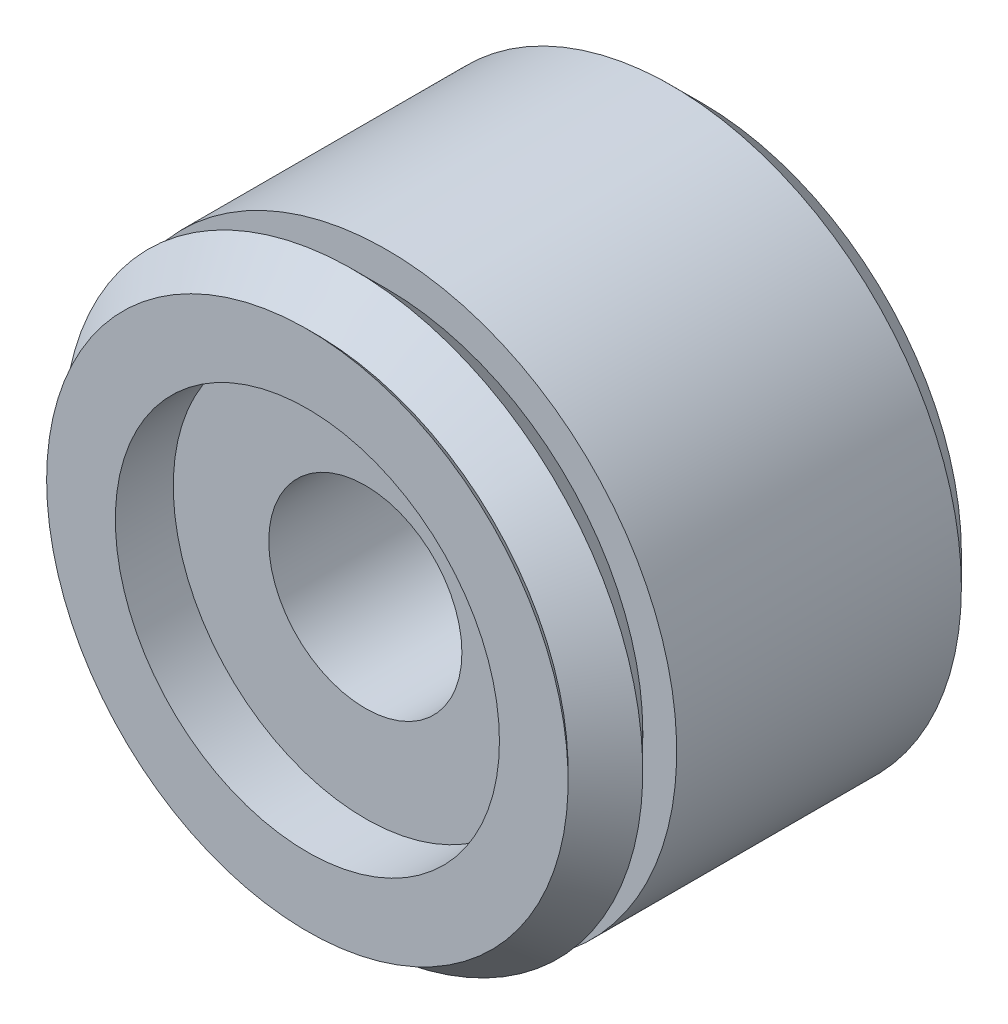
SolidWorks part; units mm, degrees
ref_plane "Front" through (0, 0, 0) normal (0, 0, 1) x (1, 0, 0)
ref_plane "Top" through (0, 0, 0) normal (0, 1, 0) x (1, 0, 0)
ref_plane "Right" through (0, 0, 0) normal (1, 0, 0) x (0, 0, -1)
sketch "Sketch1" plane through (0, 0, 0) normal (1, 0, 0) x (0, 0, -1)
  line L0 (71.2941, 0) -> (-67.6458, 0) construction
  line L1 (0, 0) -> (0, 6.858)
  line L2 (0, 6.858) -> (0.2197, 6.6383)
  line L3 (0.2197, 6.6383) -> (1.2014, 7.62)
  line L4 (1.2014, 7.62) -> (2.0932, 6.7282)
  line L5 (2.0932, 6.7282) -> (2.0932, 7.62)
  line L6 (2.0932, 7.62) -> (10.3736, 7.62)
  line L7 (10.3736, 7.62) -> (10.3736, 0)
  line L8 (10.3736, 0) -> (0, 0)
  dimension "D1" = 45
  dimension "D2" = 7.62
  dimension "D3" = 7.62
  dimension "D4" = 0.8918
  dimension "D5" = 1.2014
  dimension "D6" = 6.858
  dimension "Back Length" = 8.2804
revolve "Base" add sketch "Sketch1" angle 360 about L0
chamfer "Back Chamfer" distance 0.7937 angle 45 1 edges at (-7.62, 0, -10.3736)
sketch "Sketch2" plane through (0, 0, -10.3736) normal (0, 0, -1) x (-1, 0, 0)
  line L0 (6.6282, 0) -> (-6.4494, 0) construction
  line L1 (7.62, 4.7625) -> (-7.62, 4.7625)
  line L2 (7.62, -4.7625) -> (-7.62, -4.7625)
  line L3 (-7.62, 4.7625) -> (-7.62, 17.4625)
  line L4 (-7.62, -4.7625) -> (-7.62, -17.4625)
  line L5 (-7.62, 17.4625) -> (7.62, 17.4625)
  line L6 (-7.62, -17.4625) -> (7.62, -17.4625)
  line L7 (7.62, 17.4625) -> (7.62, 4.7625)
  line L8 (7.62, -17.4625) -> (7.62, -4.7625)
  point P5 (0, 4.7625)
  dimension "D1" = 9.525
  dimension "D2" = 12.7
  dimension "D3" = 15.24
extrude "Flats Cut" [suppressed] cut sketch "Sketch2" against normal blind 3.9688
sketch "Sketch4" plane through (0, 0, -10.3736) normal (0, 0, -1) x (-1, 0, 0)
  circle A0 centre (0, 0) radius 9.525
  dimension "D1" = 19.05
extrude "Body" [suppressed] add sketch "Sketch4" along normal blind 9.525
sketch "Sketch5" [suppressed] plane through (0, 0, -16.6982) normal (0, 0, -1) x (-1, 0, 0)
  circle A0 centre (0, 0) radius 6.35
  dimension "D1" = 12.7
extrude "Body 2" [suppressed] add sketch "Sketch5" along normal blind 12.7
chamfer "Body Chamfer" [suppressed] distance 0.7937 angle 45
sketch "Sketch6" [suppressed] plane through (0, 0, -26.2232) normal (0, 0, -1) x (-1, 0, 0)
  line L0 (0, 6.5811) -> (0, -6.7371) construction
  line L1 (-3.9687, 6.35) -> (-3.9687, -6.35)
  line L2 (3.9688, 6.35) -> (6.5088, 6.35)
  line L3 (3.9688, 6.35) -> (3.9688, -6.35)
  line L4 (3.9688, -6.35) -> (6.5088, -6.35)
  line L5 (6.5088, 6.35) -> (6.5088, -6.35)
  line L6 (-3.9687, 6.35) -> (-6.5087, 6.35)
  line L7 (-6.5087, 6.35) -> (-6.5087, -6.35)
  line L8 (-3.9687, -6.35) -> (-6.5087, -6.35)
  point P11 (3.9688, 0)
  dimension "D1" = 7.9375
  dimension "D2" = 2.54
  dimension "D3" = 12.7
extrude "Body 2 Flats Cut" [suppressed] cut sketch "Sketch6" against normal blind 11.8872
sketch "Sketch7" [suppressed] plane through (3.9687, 0, 0) normal (1, 0, 0) x (0, 0, -1)
  line L0 (12.7295, 0) -> (3.9982, 0) construction
  line L1 (26.2232, -3.8886) -> (26.2232, 3.8886) construction
  circle A0 centre (19.8732, 0) radius 1.9812
  dimension "D2" = 3.9624
  dimension "D1" = 6.35
extrude "Body 2 Hole Cut" [suppressed] cut sketch "Sketch7" against normal through all
sketch "Sketch8" [suppressed] plane through (0, 0, 0) normal (1, 0, 0) x (0, 0, -1)
  line L0 (15.9045, 0) -> (3.9982, 0) construction
  line L1 (3.9982, 9.525) -> (3.9982, -9.525) construction
  circle A0 centre (8.5194, 0) radius 2.032
  dimension "D1" = 4.064
  dimension "B4 Body Hole Distance" = 4.7752
extrude "B1" [suppressed] cut sketch "Sketch8" along normal through all
sketch "Sketch12" [suppressed] plane through (0, 0, 0) normal (0, 1, 0) x (1, 0, 0)
  line L0 (-9.525, 3.9982) -> (9.525, 3.9982) construction
  circle A0 centre (0, 8.5194) radius 2.032
  dimension "D1" = 4.064
  dimension "B1 Body Hole Distance" = 4.7752
extrude "B2" [suppressed] cut sketch "Sketch12" along normal through all
sketch "Sketch9" [suppressed] plane through (0, 0, 0) normal (1, 0, 0) x (0, 0, -1)
  line L2 (3.9982, 9.525) -> (3.9982, -9.525) construction
  circle A0 centre (8.5194, 0) radius 2.032
  dimension "D1" = 4.064
  dimension "B2 Body Hole Distance" = 4.7752
extrude "B3" [suppressed] cut sketch "Sketch9" against normal through all
sketch "Sketch13" [suppressed] plane through (0, 0, 0) normal (0, 1, 0) x (1, 0, 0)
  line L1 (-9.525, 3.9982) -> (9.525, 3.9982) construction
  circle A0 centre (0, 8.5194) radius 2.032
  dimension "D1" = 4.064
  dimension "B3 Body Hole Distance" = 4.7752
extrude "B4" [suppressed] cut sketch "Sketch13" against normal through all
sketch "Sketch3" plane through (0, 0, 0) normal (0, 0, -1) x (-1, 0, 0)
  circle A0 centre (0, 0) radius 2.54
  dimension "D1" = 5.08
extrude "Hole Cut" cut sketch "Sketch3" along normal through all
sketch "Sketch14" plane through (0, 0, 0) normal (0, 0, 1) x (1, 0, 0)
  circle A0 centre (0, 0) radius 5.0509
extrude "Cut-Extrude1" cut sketch "Sketch14" against normal blind 1.524
